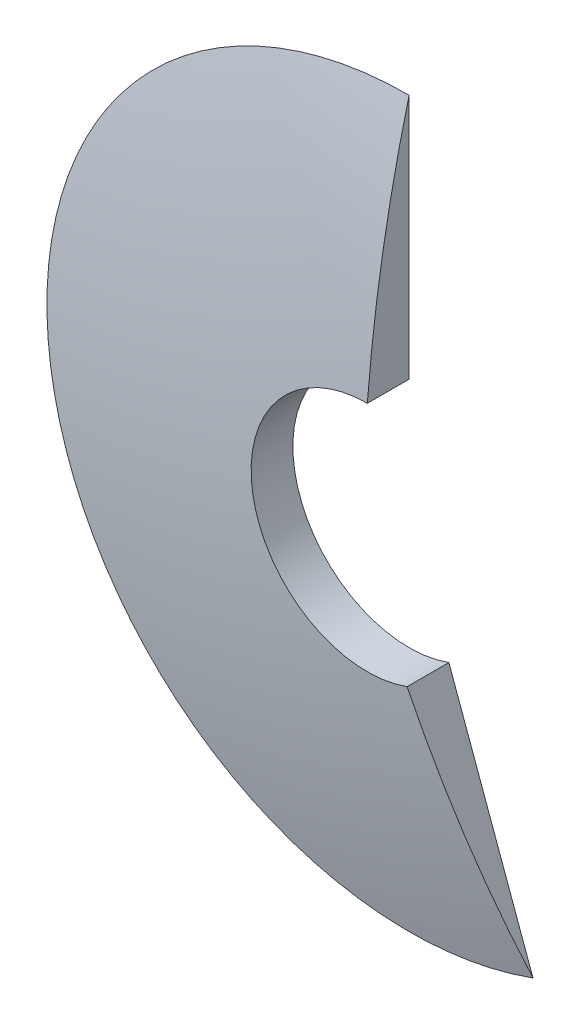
SolidWorks part; units mm, degrees
ref_plane "Přední rovina" through (0, 0, 0) normal (0, 0, 1) x (1, 0, 0)
ref_plane "Horní rovina" through (0, 0, 0) normal (0, 1, 0) x (1, 0, 0)
ref_plane "Pravá rovina" through (0, 0, 0) normal (1, 0, 0) x (0, 0, -1)
sketch "Skica1" plane through (0, 0, 0) normal (0, 0, 1) x (1, 0, 0)
  circle A0 centre (0, 0) radius 25
  circle A1 centre (0, 0) radius 77.9
extrude "Přidat vysunutím1" add sketch "Skica1" along normal blind 10
sketch "Skica2" plane through (0, 0, 0) normal (1, 0, 0) x (0, 0, -1)
  line L1 (-10, 77.9) -> (-10, -77.9) construction
  line L2 (-10, 0) -> (-24.2027, 0)
  line L3 (0, 77.9) -> (-24.2027, 77.9)
  line L4 (-24.2027, 77.9) -> (-24.2027, 0)
  arc A0 (-10, 0) -> (0, 77.9) centre (298.4205, 0) cw
revolve "Odebrat rotací2" cut sketch "Skica2" angle 360 about L2
scale "Měřítko1" scale about origin uniform scaling yes scale factor 0.655
sketch "Skica3" plane through (0, 0, 0) normal (0, 0, 1) x (1, 0, 0)
  line L0 (0, 0) -> (0, 60.6617)
  line L1 (0, 0) -> (20.7475, -57.0033)
  circle A0 centre (0, 0) radius 60.6617
  dimension "D1" = 160
extrude "Odebrat vysunutím1" cut sketch "Skica3" along normal through all contours L1 A0 L0
